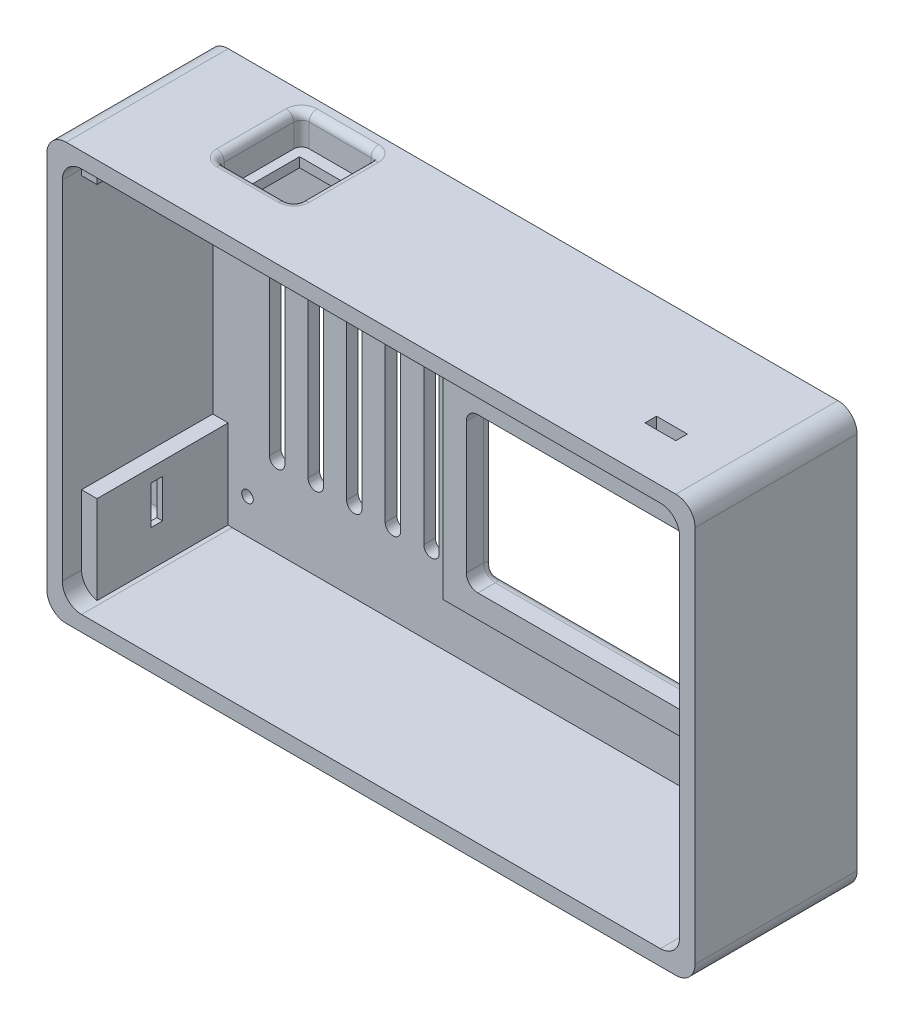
SolidWorks part; units mm, degrees
ref_plane "Ebene vorne" through (0, 0, 0) normal (0, 0, 1) x (1, 0, 0)
ref_plane "Ebene oben" through (0, 0, 0) normal (0, 1, 0) x (1, 0, 0)
ref_plane "Ebene rechts" through (0, 0, 0) normal (1, 0, 0) x (0, 0, -1)
sketch "Skizze1" plane through (0, 0, 0) normal (0, 0, 1) x (1, 0, 0)
  line L1 (0, 0) -> (168, 0)
  line L2 (0, 0) -> (0, -108)
  line L3 (0, -108) -> (168, -108)
  line L4 (168, 0) -> (168, -108)
  dimension "D1" = 168
  dimension "D2" = 108
extrude "Aufsatz-Linear austragen1" add sketch "Skizze1" along normal blind 42
sketch "Skizze2" plane through (0, 0, 42) normal (0, 0, 1) x (1, 0, 0)
  line L0 (168, 0) -> (0, 0) construction
  line L1 (4, -4) -> (164, -4)
  line L2 (4, -4) -> (4, -104)
  line L3 (4, -104) -> (164, -104)
  line L4 (164, -4) -> (164, -104)
  line L5 (0, 0) -> (0, -108) construction
  dimension "D1" = 160
  dimension "D2" = 100
  dimension "D3" = 4
  dimension "D4" = 4
extrude "Schnitt-Linear austragen1" cut sketch "Skizze2" against normal blind 39
fillet "Verrundung1" radius 5 4 edges at (4, -104, 22.5) (164, -104, 22.5) (164, -4, 22.5) (4, -4, 22.5)
fillet "Verrundung2" radius 5 4 edges at (0, 0, 21) (0, -108, 21) (168, -108, 21) (168, 0, 21)
sketch "Skizze3" plane through (0, 0, 0) normal (0, 0, -1) x (-1, 0, 0)
  line L0 (-168, -103) -> (-168, -5) construction
  line L1 (-147.7, -42.3) -> (-74.2, -42.3)
  line L2 (-147.7, -42.3) -> (-147.7, -82.3)
  line L3 (-147.7, -82.3) -> (-74.2, -82.3)
  line L4 (-74.2, -42.3) -> (-74.2, -82.3)
  line L5 (-5, -108) -> (-163, -108) construction
  dimension "D1" = 20.3
  dimension "D2" = 25.7
  dimension "D3" = 73.5
  dimension "D4" = 40
extrude "Schnitt-Linear austragen2" cut sketch "Skizze3" against normal blind 39
sketch "Skizze4" plane through (0, 0, 0) normal (0, 0, -1) x (-1, 0, 0)
  line L0 (-168, -103) -> (-168, -5) construction
  line L1 (-5, -108) -> (-163, -108) construction
  line L2 (-84, 0) -> (-84, -108) construction
  line L3 (-163, 0) -> (-5, 0) construction
  line L4 (-168, -54) -> (0, -54) construction
  line L5 (0, -5) -> (0, -103) construction
  circle A0 centre (-155, -95) radius 1.5
  circle A1 centre (-13, -95) radius 1.5
  circle A2 centre (-155, -13) radius 1.5
  circle A3 centre (-13, -37) radius 1.5
  dimension "D1" = 13
  dimension "D2" = 13
  dimension "D3" = 58
  dimension "D4" = 13
  dimension "D5" = 3
  dimension "3" = 3
extrude "Schnitt-Linear austragen3" cut sketch "Skizze4" against normal blind 39
sketch "Skizze5" plane through (0, 0, 3) normal (0, 0, 1) x (1, 0, 0)
  line L1 (74.2, -42.3) -> (147.7, -42.3)
  line L2 (74.2, -42.3) -> (74.2, -82.3)
  line L3 (74.2, -82.3) -> (147.7, -82.3)
  line L4 (147.7, -42.3) -> (147.7, -82.3)
  line L5 (68.2, -36.3) -> (153.7, -36.3)
  line L6 (68.2, -36.3) -> (68.2, -88.3)
  line L7 (68.2, -88.3) -> (153.7, -88.3)
  line L8 (153.7, -36.3) -> (153.7, -88.3)
  dimension "D1" = 85.5
  dimension "D2" = 52
  dimension "D3" = 6
  dimension "D4" = 6
extrude "Aufsatz-Linear austragen2" add sketch "Skizze5" along normal blind 4.5
sketch "Skizze6" plane through (0, 0, 0) normal (0, 0, -1) x (-1, 0, 0)
  line L0 (-163, 0) -> (-5, 0) construction
  line L1 (-168, -103) -> (-168, -5) construction
  line L3 (-168, -103) -> (-168, -5) construction
  circle A2 centre (-134.5, -16) radius 5.25
  circle A3 centre (-111.5, -16) radius 5.25
  dimension "D1" = 10.5
  dimension "D2" = 10.5
  dimension "D3" = 16
  dimension "D4" = 33.5
  dimension "D5" = 16
  dimension "D6" = 56.5
extrude "Schnitt-Linear austragen5" cut sketch "Skizze6" against normal through all
sketch "Skizze9" plane through (0, 0, 3) normal (0, 0, 1) x (1, 0, 0)
  line L0 (164, -99) -> (164, -9) construction
  line L1 (4, -4) -> (164, -4)
  line L2 (4, -4) -> (4, -8.5)
  line L3 (4, -8.5) -> (164, -8.5)
  line L4 (164, -4) -> (164, -8.5)
  dimension "D1" = 160
  dimension "D2" = 4.5
extrude "Aufsatz-Linear austragen4" add sketch "Skizze9" along normal blind 34
sketch "Skizze10" plane through (0, 0, 0) normal (0, 1, 0) x (1, 0, 0)
  line L0 (168, 0) -> (168, -42) construction
  line L1 (143, -27) -> (151, -27)
  line L2 (143, -27) -> (143, -30)
  line L3 (143, -30) -> (151, -30)
  line L4 (151, -27) -> (151, -30)
  line L5 (163, -42) -> (5, -42) construction
  dimension "D1" = 8
  dimension "D2" = 3
  dimension "D3" = 17
  dimension "D4" = 12
extrude "Schnitt-Linear austragen6" cut sketch "Skizze10" against normal blind 12
sketch "Skizze12" plane through (0, 0, 0) normal (0, 1, 0) x (1, 0, 0)
  line L0 (0, -42) -> (0, 0) construction
  line L1 (30.5, -7) -> (45.5, -7)
  line L2 (30.5, -7) -> (30.5, -23)
  line L3 (30.5, -23) -> (45.5, -23)
  line L4 (45.5, -7) -> (45.5, -23)
  line L5 (163, -42) -> (5, -42) construction
  dimension "D1" = 15
  dimension "D2" = 16
  dimension "D3" = 30.5
  dimension "D4" = 19
extrude "Schnitt-Linear austragen8" cut sketch "Skizze12" against normal blind 12
sketch "Skizze13" plane through (0, 0, 0) normal (0, 1, 0) x (1, 0, 0)
  line L0 (30.5, -7) -> (30.5, -23) construction
  line L1 (28, -4) -> (48, -4)
  line L2 (28, -4) -> (28, -26)
  line L3 (28, -26) -> (48, -26)
  line L4 (48, -4) -> (48, -26)
  line L5 (45.5, -7) -> (30.5, -7) construction
  dimension "D1" = 20
  dimension "D2" = 22
  dimension "D3" = 3
  dimension "D4" = 2.5
extrude "Schnitt-Linear austragen10" cut sketch "Skizze13" against normal blind 8
sketch "Skizze14" plane through (0, -8.5, 0) normal (0, -1, 0) x (-1, 0, 0)
  line L1 (-5, -26) -> (-63, -26)
  line L2 (-5, -26) -> (-5, -3)
  line L3 (-5, -3) -> (-63, -3)
  line L4 (-63, -26) -> (-63, -3)
  line L5 (-45.5, -23) -> (-45.5, -7) construction
  line L8 (-30.5, -23) -> (-45.5, -23)
  line L9 (-30.5, -23) -> (-30.5, -7)
  line L10 (-30.5, -7) -> (-45.5, -7)
  line L11 (-45.5, -23) -> (-45.5, -7)
  dimension "D1" = 58
  dimension "D2" = 23
  dimension "D3" = 17.5
extrude "Aufsatz-Linear austragen10" add sketch "Skizze14" along normal blind 2
sketch "Skizze15" plane through (0, 0, 3) normal (0, 0, 1) x (1, 0, 0)
  line L0 (9, -104) -> (159, -104) construction
  line L1 (4, -4) -> (8, -4)
  line L2 (4, -4) -> (4, -104)
  line L3 (4, -104) -> (8, -104)
  line L4 (8, -4) -> (8, -104)
  dimension "D1" = 4
extrude "Aufsatz-Linear austragen11" add sketch "Skizze15" along normal blind 34
sketch "Skizze16" plane through (0, 0, 0) normal (-1, 0, 0) x (0, 0, 1)
  line L0 (42, -5) -> (42, -103) construction
  line L1 (20, -84.5) -> (23, -84.5)
  line L2 (20, -84.5) -> (20, -94.5)
  line L3 (20, -94.5) -> (23, -94.5)
  line L4 (23, -84.5) -> (23, -94.5)
  line L5 (42, -108) -> (0, -108) construction
  dimension "D1" = 10
  dimension "D2" = 3
  dimension "D3" = 19
  dimension "D4" = 13.5
extrude "Schnitt-Linear austragen11" cut sketch "Skizze16" against normal blind 12
sketch "Skizze19" plane through (0, 0, 0) normal (0, 0, -1) x (-1, 0, 0)
  line L0 (-60.6821, -33) -> (-60.6821, -83) construction
  line L1 (-20.6821, -33) -> (-20.6821, -83) construction
  line L2 (-58.6821, -33) -> (-58.6821, -83)
  line L3 (-62.6821, -33) -> (-62.6821, -83)
  line L4 (-18.6821, -33) -> (-18.6821, -83)
  line L5 (-5, -108) -> (-163, -108) construction
  line L6 (-50.6821, -33) -> (-50.6821, -83) construction
  line L7 (-48.6821, -33) -> (-48.6821, -83)
  line L8 (-52.6821, -33) -> (-52.6821, -83)
  line L9 (-40.6821, -33) -> (-40.6821, -83) construction
  line L10 (-38.6821, -33) -> (-38.6821, -83)
  line L11 (-42.6821, -33) -> (-42.6821, -83)
  line L12 (-30.6821, -33) -> (-30.6821, -83) construction
  line L13 (-28.6821, -33) -> (-28.6821, -83)
  line L14 (-32.6821, -33) -> (-32.6821, -83)
  line L15 (-22.6821, -33) -> (-22.6821, -83)
  arc A0 (-58.6821, -33) -> (-62.6821, -33) centre (-60.6821, -33) ccw
  arc A1 (-62.6821, -83) -> (-58.6821, -83) centre (-60.6821, -83) ccw
  arc A2 (-48.6821, -33) -> (-52.6821, -33) centre (-50.6821, -33) ccw
  arc A3 (-52.6821, -83) -> (-48.6821, -83) centre (-50.6821, -83) ccw
  arc A4 (-38.6821, -33) -> (-42.6821, -33) centre (-40.6821, -33) ccw
  arc A5 (-42.6821, -83) -> (-38.6821, -83) centre (-40.6821, -83) ccw
  arc A6 (-28.6821, -33) -> (-32.6821, -33) centre (-30.6821, -33) ccw
  arc A7 (-32.6821, -83) -> (-28.6821, -83) centre (-30.6821, -83) ccw
  arc A8 (-18.6821, -33) -> (-22.6821, -33) centre (-20.6821, -33) ccw
  arc A9 (-22.6821, -83) -> (-18.6821, -83) centre (-20.6821, -83) ccw
  point P4 (-60.6821, -58)
  point P13 (-50.6821, -58)
  point P20 (-40.6821, -58)
  point P27 (-30.6821, -58)
  point P34 (-20.6821, -58)
  dimension "D2" = 50
  dimension "D3" = 50
  dimension "D1" = 4
  dimension "D4" = 10
  dimension "D5" = 10
  dimension "D6" = 10
  dimension "D7" = 50
  dimension "D8" = 50
  dimension "D9" = 50
  dimension "D10" = 50
  dimension "D11" = 50
  dimension "D12" = 50
  dimension "D13" = 50
  dimension "D14" = 50
  dimension "D15" = 10
  dimension "D16" = 4
  dimension "D17" = 4
  dimension "D18" = 4
  dimension "D19" = 4
extrude "Schnitt-Linear austragen13" cut sketch "Skizze19" against normal through all
fillet "Verrundung4" radius 1 4 edges at (14.5, -95, 0) (11.5, -37, 0) (153.5, -95, 0) (156.5, -13, 0)
fillet "Verrundung8" radius 3 4 edges at (110.95, -82.3, 0) (74.2, -62.3, 0) (147.7, -62.3, 0) (110.95, -42.3, 0)
fillet "Verrundung10" radius 3 8 edges at (147.7, -82.3, 5.25) (74.2, -82.3, 5.25) (74.2, -42.3, 5.25) (147.7, -42.3, 5.25) (148.5787, -83.1787, 0.8787) (73.3213, -83.1787, 0.8787) (73.3213, -41.4213, 0.8787) (148.5787, -41.4213, 0.8787)
sketch "Skizze20" plane through (0, 0, 0) normal (0, 0, -1) x (-1, 0, 0)
  line L0 (-163, 0) -> (-5, 0) construction
  circle A0 centre (-89.5, -16) radius 1.5
  circle A2 centre (-111.5, -16) radius 5.25 construction
  dimension "D1" = 3
  dimension "D2" = 16
  dimension "D3" = 22
extrude "Schnitt-Linear austragen14" cut sketch "Skizze20" against normal through all
sketch "Skizze21" plane through (0, 0, 0) normal (-1, 0, 0) x (0, 0, 1)
  line L0 (20, -94.5) -> (23, -94.5) construction
  line L1 (18.5, -83.5) -> (25, -83.5)
  line L2 (18.5, -83.5) -> (18.5, -95.5)
  line L3 (18.5, -95.5) -> (25, -95.5)
  line L4 (25, -83.5) -> (25, -95.5)
  line L5 (23, -94.5) -> (23, -84.5) construction
  dimension "D1" = 12
  dimension "D2" = 6.5
  dimension "D3" = 1
  dimension "D4" = 2
extrude "Schnitt-Linear austragen15" cut sketch "Skizze21" against normal blind 6.5
sketch "Skizze22" plane through (0, 0, 37) normal (0, 0, 1) x (1, 0, 0)
  line L1 (8, -81) -> (4, -81)
  line L2 (8, -81) -> (8, -10.5)
  line L3 (8, -10.5) -> (4, -10.5)
  line L4 (4, -81) -> (4, -10.5)
  line L6 (5, -108) -> (163, -108) construction
  point P11 (0, 0)
  dimension "D1" = 70.5
  dimension "D2" = 4
  dimension "D3" = 27
extrude "Schnitt-Linear austragen18" cut sketch "Skizze22" against normal blind 34 contours L2 L1 L4 L3
fillet "Verrundung11" radius 2 4 edges at (3.25, -83.5, 25) (3.25, -83.5, 18.5) (3.25, -95.5, 18.5) (3.25, -95.5, 25)
fillet "Verrundung12" radius 2 4 edges at (28, -4, 4) (48, -4, 4) (28, -4, 26) (48, -4, 26)
fillet "Verrundung13" radius 2 8 edges at (47.4142, 0, 25.4142) (47.4142, 0, 4.5858) (28.5858, 0, 4.5858) (28.5858, 0, 25.4142) (38, 0, 26) (28, 0, 15) (48, 0, 15) (38, 0, 4)
